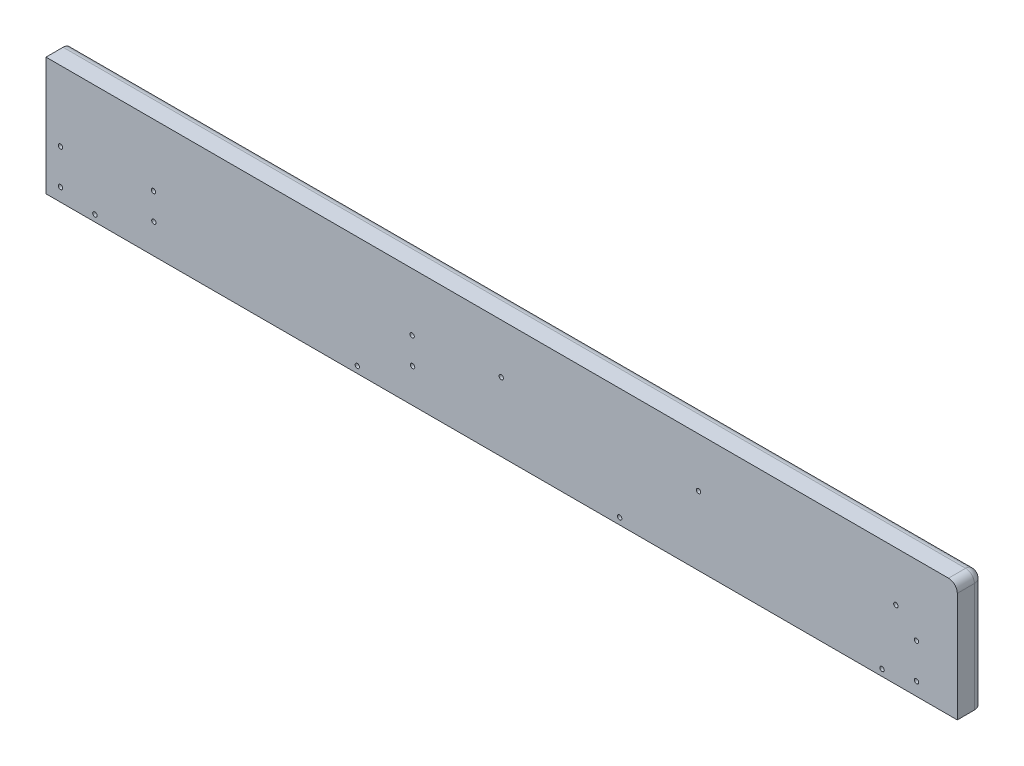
SolidWorks part; units mm, degrees
ref_plane "Спереди" through (0, 0, 0) normal (0, 0, 1) x (1, 0, 0)
ref_plane "Сверху" through (0, 0, 0) normal (0, 1, 0) x (1, 0, 0)
ref_plane "Справа" through (0, 0, 0) normal (1, 0, 0) x (0, 0, -1)
sketch "Эскиз1" plane through (0, 0, 0) normal (0, 0, 1) x (1, 0, 0)
  line L0 (929, -113) -> (479, -113) construction
  line L1 (-1009, 0) -> (1009, 0)
  line L2 (-1009, 0) -> (-1009, -270)
  line L3 (-1009, -270) -> (1009, -270)
  line L4 (1009, 0) -> (1009, -270)
  line L5 (0, -270) -> (0, 0) construction
  line L6 (479, -113) -> (29, -113) construction
  line L7 (897.5, -255) -> (299.1667, -255) construction
  line L8 (299.1667, -255) -> (-299.1667, -255) construction
  line L9 (-299.1667, -255) -> (-897.5, -255) construction
  circle A0 centre (929, -113) radius 5
  circle A1 centre (29, -113) radius 5
  circle A4 centre (479, -113) radius 5
  circle A9 centre (976, -160) radius 5
  circle A10 centre (976, -240) radius 5
  circle A11 centre (-976, -240) radius 5
  circle A12 centre (-976, -160) radius 5
  circle A13 centre (-897.5, -255) radius 5
  circle A14 centre (-299.1667, -255) radius 5
  circle A15 centre (299.1667, -255) radius 5
  circle A16 centre (897.5, -255) radius 5
  dimension "D3" = 10
  dimension "D6" = 80
  dimension "D7" = 30
  dimension "D12" = 111.5
  dimension "D1" = 270
  dimension "D2" = 2018
  dimension "D4" = 80
  dimension "D5" = 157
  dimension "D8" = 33
  dimension "D9" = 450
  dimension "D10" = 15
  dimension "D11" = 111.5
extrude "Бобышка-Вытянуть1" add sketch "Эскиз1" along normal blind 16
sketch "Эскиз2" plane through (0, 0, 0) normal (0, 0, -1) x (-1, 0, 0)
  line L1 (764, -142) -> (174.0848, -132) construction
  line L2 (764, -142) -> (762.9831, -201.9914) construction
  line L3 (762.9831, -201.9914) -> (173.0678, -191.9914) construction
  line L4 (174.0848, -132) -> (173.0678, -191.9914) construction
  line L6 (1009, 0) -> (1009, -270) construction
  circle A0 centre (173.0678, -191.9914) radius 5
  circle A1 centre (174.0848, -132) radius 5
  circle A2 centre (764, -142) radius 5
  circle A3 centre (762.9831, -201.9914) radius 5
  circle A5 centre (-29, -113) radius 5 construction
  dimension "D1" = 10
  dimension "D4" = 10
  dimension "D5" = 245
  dimension "D6" = 19
  dimension "D2" = 60
  dimension "D3" = 590
extrude "Вырез-Вытянуть1" cut sketch "Эскиз2" against normal through all
other "Переместить грань1" [suppressed] parameters "D1"=15
sketch "Эскиз3" plane through (0, 0, 0) normal (0, 0, -1) x (-1, 0, 0)
  line L4 (1009, -270) -> (1009, 0)
  line L5 (1009, 0) -> (-1009, 0)
  line L6 (-1009, 0) -> (-1009, -270)
  line L7 (-1009, -270) -> (1009, -270)
  line L8 (1009, -270) -> (1009, 0)
  line L9 (1009, 0) -> (-1009, 0)
  line L10 (-1009, 0) -> (-1009, -270)
  line L11 (-1009, -270) -> (1009, -270)
  dimension "D1" = 0
extrude "Бобышка-Вытянуть2" add sketch "Эскиз3" along normal blind 43
fillet "Скругление1" radius 20 1 edges at (0, 0, -43)
other "Переместить грань2" parameters "D1"=60
fillet "Скругление2" radius 20 3 edges at (1069, 0, -3.5) (1069, -5.8579, -37.1421) (1069, -145, -43)
